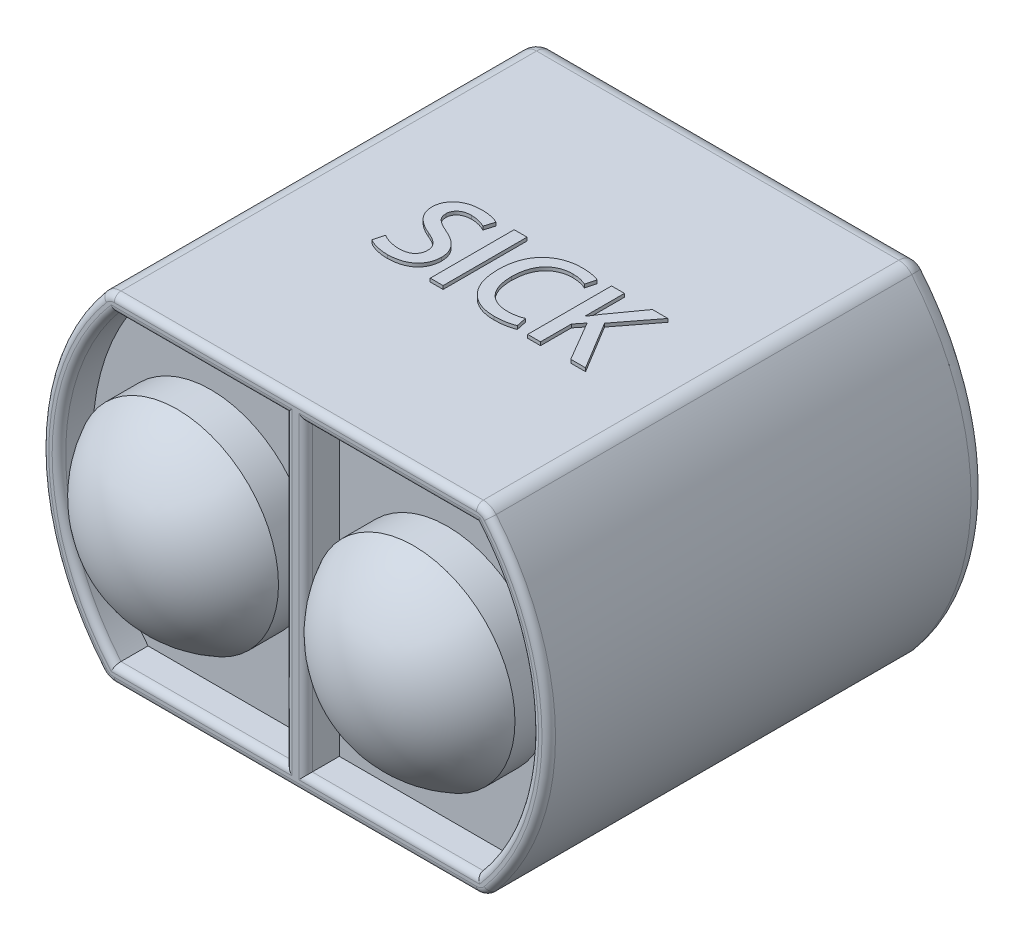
SolidWorks part; units mm, degrees
ref_plane "前视基准面" through (0, 0, 0) normal (0, 0, 1) x (1, 0, 0)
ref_plane "上视基准面" through (0, 0, 0) normal (0, 1, 0) x (1, 0, 0)
ref_plane "右视基准面" through (0, 0, 0) normal (1, 0, 0) x (0, 0, -1)
sketch "草图1" plane through (0, 0, 0) normal (0, 0, 1) x (1, 0, 0)
  line L1 (-5.5902, 0) -> (5.5902, 0)
  line L3 (-5.5902, 10) -> (5.5902, 10)
  arc A0 (5.5902, 0) -> (5.5902, 10) centre (0, 5) ccw
  arc A1 (-5.5902, 10) -> (-5.5902, 0) centre (0, 5) ccw
extrude "凸台-拉伸1" add sketch "草图1" against normal blind 13
ref_plane "基准面1" through (0, 5, 0) normal (0, 1, 0) x (1, 0, 0)
sketch "草图3" plane through (0, 5, 0) normal (0, 1, 0) x (1, 0, 0)
  line L0 (-3.5, -1.9524) -> (-3.5, 1.8554) construction
  line L1 (-3.5, -1.8541) -> (-3.5, 0)
  line L2 (-3.5, 0) -> (-0.5, 0)
  line L3 (-5.5902, 0) -> (5.5902, 0) construction
  arc A0 (-3.5, -1.8541) -> (-0.5, 0) centre (-3.5, 1.5) ccw
revolve "旋转1" add sketch "草图3" angle 360 about L0
mirror "镜向1" about plane through (0, 0, 0) normal (1, 0, 0) of "旋转1"
sketch "草图5" plane through (0, 0, 0) normal (0, 0, 1) x (1, 0, 0)
  line L0 (0.3, 9.5) -> (5.3619, 9.5)
  line L1 (-5.3619, 9.5) -> (-0.3, 9.5)
  line L2 (0.3, 0.5) -> (5.3619, 0.5)
  line L3 (-5.3619, 0.5) -> (-0.3, 0.5)
  line L4 (-0.3, 9.5) -> (-0.3, 0.5)
  line L6 (0.3, 9.5) -> (0.3, 0.5)
  arc A0 (-5.3619, 9.5) -> (-5.3619, 0.5) centre (0, 5) ccw
  arc A1 (5.3619, 0.5) -> (5.3619, 9.5) centre (0, 5) ccw
  circle A2 centre (-3.5, 5) radius 3
  circle A3 centre (3.5, 5) radius 3
extrude "切除-拉伸3" cut sketch "草图5" against normal blind 1
fillet "圆角3" radius 0.5 8 edges at (0, 10, -13) (-7.5, 5, -13) (0, 0, -13) (7.5, 5, -13) (-5.5902, 0, -6.5) (5.5902, 0, -6.5) (-5.5902, 10, -6.5) (5.5902, 10, -6.5)
fillet "圆角4" radius 0.2 16 edges at (-5.5732, 9.9532, 0) (0, 10, 0) (5.5732, 9.9532, 0) (7.5, 5, 0) (5.5732, 0.0468, 0) (0, 0, 0) (-5.5732, 0.0468, 0) (-7.5, 5, 0) (-2.831, 0.5, 0) (-0.3, 5, 0) (-2.831, 9.5, 0) (-7, 5, 0) (2.831, 9.5, 0) (0.3, 5, 0) (2.831, 0.5, 0) (7, 5, 0)
sketch "草图6" plane through (0, 10, 0) normal (0, 1, 0) x (1, 0, 0)
  text T0 "SICK" font "@Adobe 黑体 Std R" height in points 8
wrap "包覆1" sketch "草图6" wrap type emboss source sketch "草图6" thickness 0.1 parameters "D1"=0.1
